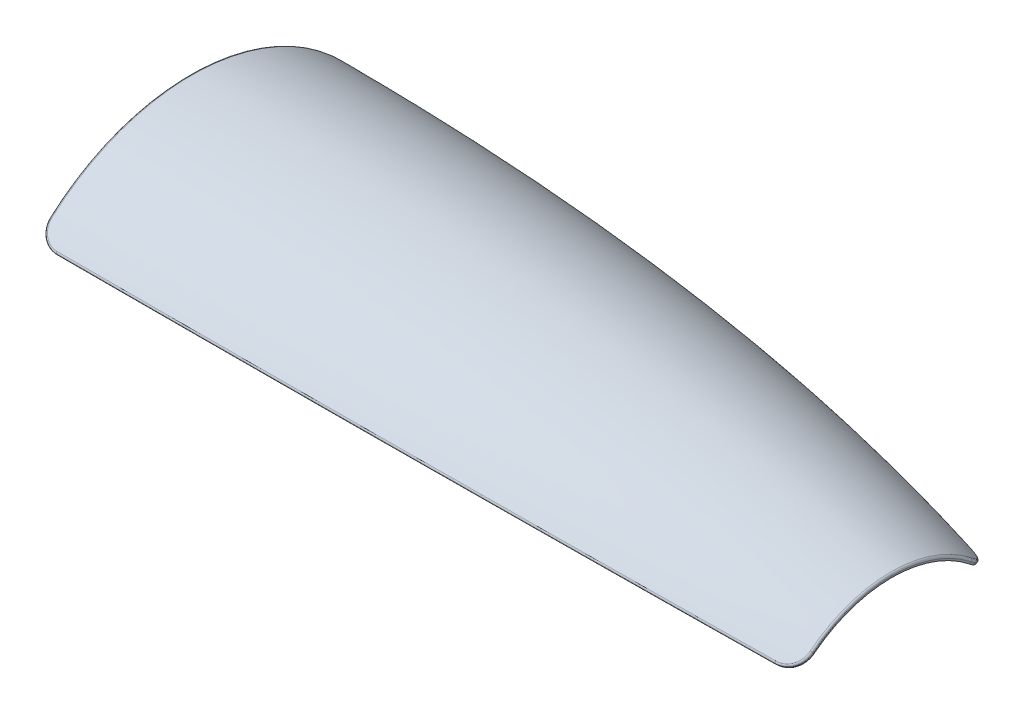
SolidWorks part; units mm, degrees
ref_plane "Plan de face" through (0, 0, 0) normal (0, 0, 1) x (1, 0, 0)
ref_plane "Plan de dessus" through (0, 0, 0) normal (0, 1, 0) x (1, 0, 0)
ref_plane "Plan de droite" through (0, 0, 0) normal (1, 0, 0) x (0, 0, -1)
sketch "Esquisse1" plane through (0, 0, 0) normal (0, 0, 1) x (1, 0, 0)
  line L0 (1937.5186, 118.6008) -> (1937.5186, 33.3089) construction
  line L1 (942.5017, 0) -> (1327.7299, 0) construction
  line L2 (1438.1567, 0) -> (2177.3993, 0) construction
  line L3 (2047, 0) -> (1597, 0) construction
  line L4 (1937.5186, 60.5987) -> (1938.0448, 62.5283)
  line L5 (1597, 102) -> (1597, 100)
  spline S0 degree 3 poles (609.8277, -59.5928) (1435.3906, 164.1167) (2212.55, 34.6313) (2075.8351, -47.2571) (1184.8244, -506.5688) knots -0.725956 -0.725956 -0.725956 -0.725956 0.598241 2.066098 2.066098 2.066098 2.066098 only from (1597, 100) to (2047, 0) construction
  spline S1 degree 3 poles (1597, 100) (1755.2575, 100) (1863.5764, 80.7626) (1937.5186, 60.5987) knots 0 0 0 0 0.523813 0.523813 0.523813 0.523813
  spline S2 degree 1 poles (1597, 102) (1938.0448, 62.5283) knots 0 0 1 1 construction
  spline S3 degree 3 poles (1597, 102) (1599.4631, 102) (1604.407, 101.9906) (1614.1538, 101.9347) (1626.1714, 101.7965) (1640.2993, 101.5244) (1658.7601, 101.0247) (1681.1327, 100.1514) (1706.8786, 98.7325) (1731.5456, 96.9694) (1763.0269, 94.1956) (1799.7952, 90.0019) (1833.2706, 85.0185) (1858.166, 80.6653) (1875.9177, 77.244) (1892.7722, 73.6931) (1906.0891, 70.6485) (1916.3162, 68.1749) (1923.7774, 66.3039) (1929.8189, 64.7355) (1934.5576, 63.4742) (1936.879, 62.8462) (1938.0448, 62.5283) knots 0 0 0 0 0.008185 0.016369 0.032738 0.049107 0.065477 0.098215 0.130953 0.163692 0.19643 0.261907 0.327383 0.360122 0.39286 0.425598 0.458337 0.474706 0.491075 0.507444 0.515629 0.523813 0.523813 0.523813 0.523813
  dimension "D1" = 2
revolve "Révolution1" add sketch "Esquisse1" angle 95 about L1
fillet "Congé1" radius 10 4 edges at (1937.7817, 41.5917, 45.3894) (1937.7817, 41.5917, -45.3894) (1597, 68.2346, -74.465) (1597, 68.2346, 74.465)
fillet "Congé2" radius 1 8 edges at (1934.6039, 44.461, 45.2801) (1938.0448, 62.5283, 0) (1935.8784, 45.1392, -44.1146) (1600.754, 70.5069, -73.7023) (1597, 102, 0) (1599.1806, 71.6393, 72.6055)
